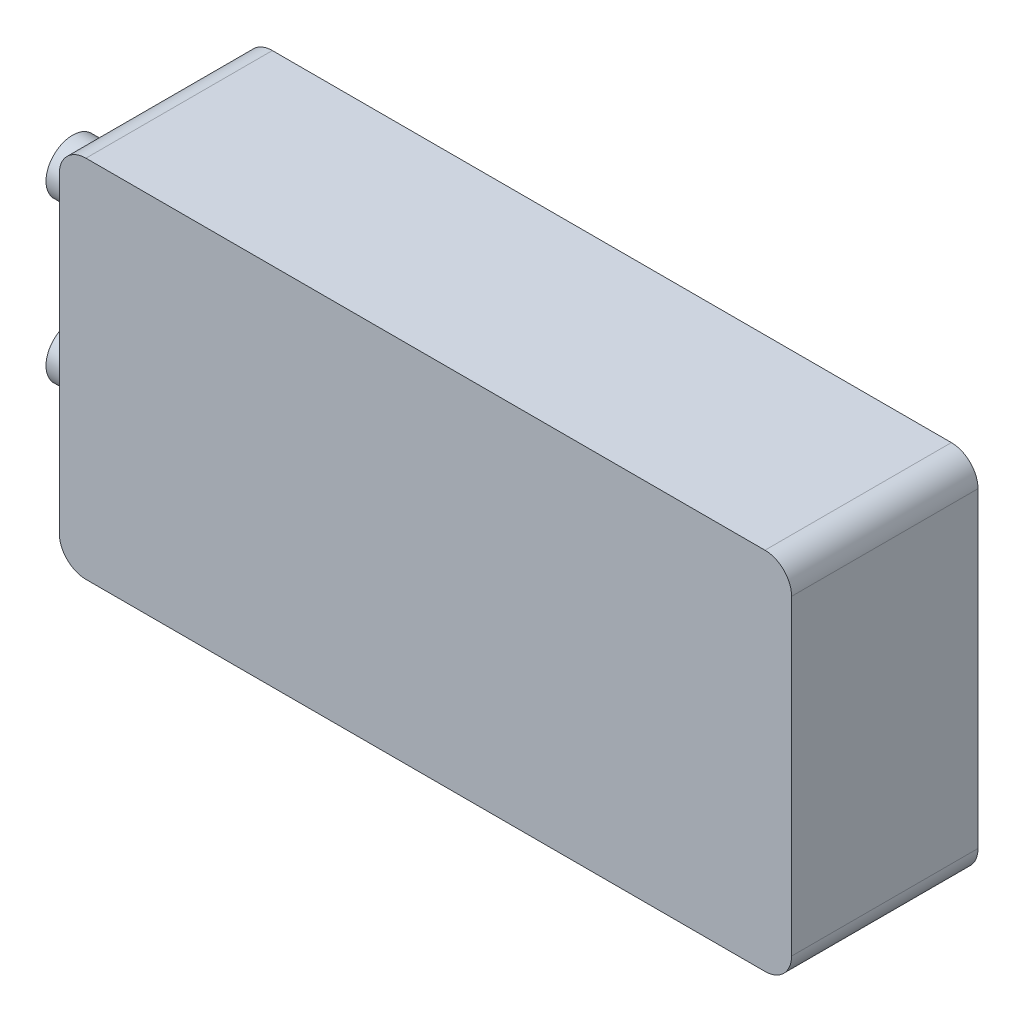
SolidWorks part; units mm, degrees
ref_plane "Front Plane" through (0, 0, 0) normal (0, 0, 1) x (1, 0, 0)
ref_plane "Top Plane" through (0, 0, 0) normal (0, 1, 0) x (1, 0, 0)
ref_plane "Right Plane" through (0, 0, 0) normal (1, 0, 0) x (0, 0, -1)
sketch "Sketch1" plane through (0, 0, 0) normal (0, 0, 1) x (1, 0, 0)
  line L1 (-34.925, 17.399) -> (34.925, 17.399)
  line L2 (-34.925, 17.399) -> (-34.925, -17.399)
  line L3 (-34.925, -17.399) -> (34.925, -17.399)
  line L4 (34.925, 17.399) -> (34.925, -17.399)
  line L5 (-34.925, 17.399) -> (34.925, -17.399) construction
  line L6 (-34.925, -17.399) -> (34.925, 17.399) construction
  point P0 (0, 0)
  dimension "D1" = 69.85
  dimension "D2" = 34.798
extrude "Boss-Extrude1" add sketch "Sketch1" along normal blind 17.78
fillet "Fillet1" radius 2.54 4 edges at (34.925, -17.399, 8.89) (34.925, 17.399, 8.89) (-34.925, -17.399, 8.89) (-34.925, 17.399, 8.89)
sketch "Sketch2" plane through (-34.925, 0, 0) normal (-1, 0, 0) x (0, 0, 1)
  line L0 (0, 14.859) -> (0, -14.859) construction
  line L1 (17.78, 14.859) -> (0, 14.859) construction
  circle A0 centre (8.89, 7.239) radius 2.54
  circle A1 centre (8.89, -8.001) radius 2.54
  dimension "D1" = 5.08
  dimension "D2" = 5.08
  dimension "D4" = 8.89
  dimension "D5" = 7.62
  dimension "D3" = 15.24
extrude "Boss-Extrude2" add sketch "Sketch2" along normal blind 7.62
